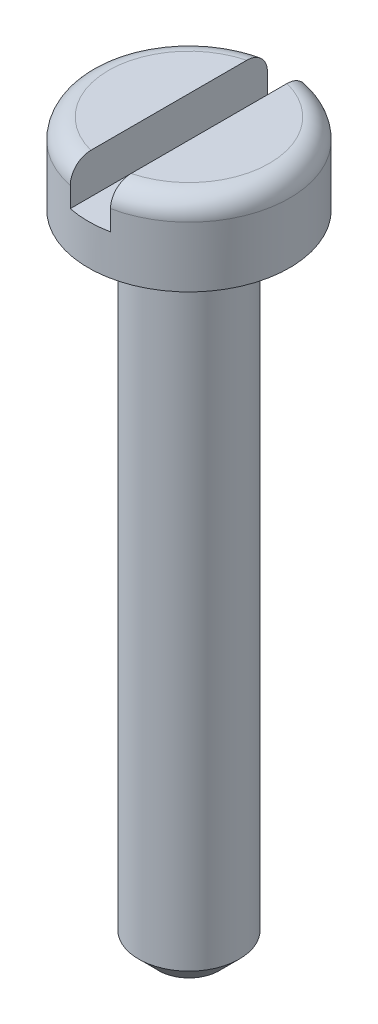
SolidWorks part; units mm, degrees
ref_plane "Plan de face" through (0, 0, 0) normal (0, 0, 1) x (1, 0, 0)
ref_plane "Plan de dessus" through (0, 0, 0) normal (0, 1, 0) x (1, 0, 0)
ref_plane "Plan de droite" through (0, 0, 0) normal (1, 0, 0) x (0, 0, -1)
sketch "Esquisse2" plane through (0, 0, 0) normal (1, 0, 0) x (0, 0, -1)
  line L0 (0, 0) -> (0, 18)
  line L1 (0, 18) -> (2, 18)
  line L2 (2.5, 17.5) -> (2.5, 16)
  line L3 (2.5, 16) -> (1.25, 16)
  line L4 (1.25, 16) -> (1.25, 0)
  line L5 (1.25, 0) -> (0, 0)
  arc A0 (2, 18) -> (2.5, 17.5) centre (2, 17.5) cw
  dimension "D1" = 1.25
  dimension "D6" = 0.5
  dimension "D2" = 2
  dimension "D3" = 2.5
  dimension "D4" = 16
revolve "Révolution1" add sketch "Esquisse2" angle 360 about L0
sketch "Esquisse3" plane through (0, 0, 0) normal (0, 0, 1) x (1, 0, 0)
  line L0 (2, 18) -> (-2, 18) construction
  line L1 (-0.5, 19) -> (0.5, 19)
  line L2 (-0.5, 19) -> (-0.5, 17)
  line L3 (-0.5, 17) -> (0.5, 17)
  line L4 (0.5, 19) -> (0.5, 17)
  line L5 (-0.5, 19) -> (0.5, 17) construction
  line L6 (-0.5, 17) -> (0.5, 19) construction
  point P0 (0, 18)
  dimension "D1" = 1
  dimension "D2" = 1
extrude "Enlèv. mat.-Extru.1" cut sketch "Esquisse3" against normal through all both and the other way through all
chamfer "Chanfrein1" distance 0.5 angle 45 1 edges at (0, 0, -1.25)
